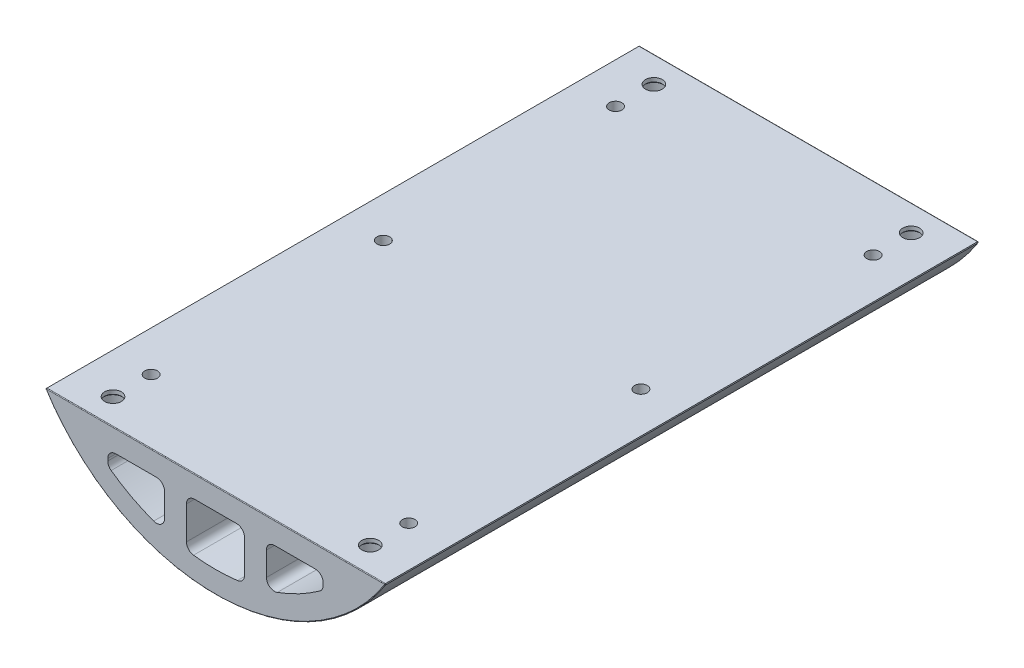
SolidWorks part; units mm, degrees
ref_plane "Plane1" through (0, 0, 0) normal (0, 0, 1) x (1, 0, 0)
ref_plane "Plane2" through (0, 0, 0) normal (0, 1, 0) x (1, 0, 0)
ref_plane "Plane3" through (0, 0, 0) normal (1, 0, 0) x (0, 0, -1)
sketch "Sketch1" plane through (0, 0, 0) normal (0, 0, 1) x (1, 0, 0)
  line L0 (-49.8614, 0) -> (45.8725, 0) construction
  line L1 (0, 51.6066) -> (0, 0) construction
  line L2 (-33.5501, -21.082) -> (33.5501, -21.082)
  line L3 (0, -21.082) -> (0, -39.624) construction
  arc A0 (-33.5501, -21.082) -> (33.5501, -21.082) centre (0, 0) ccw
  arc A2 (-31.7358, -21.082) -> (31.7358, -21.082) centre (0, 0) ccw construction
  dimension "D1" = 79.248
  dimension "D3" = 76.2
  dimension "D2" = 18.542
  dimension "D4" = 21.082
extrude "Base-Extrude" add sketch "Sketch1" along normal mid plane 116.8
sketch "Sketch2" plane through (0, -21.082, 0) normal (0, 1, 0) x (-1, 0, 0)
  line L0 (0, -61.974) -> (0, 64.7864) construction
  line L1 (0, 58.4) -> (0, -58.4) construction
  line L2 (43.7533, 0) -> (-38.0219, 0) construction
  point P7 (25.325, -53.25)
  point P8 (25.325, 53.25)
  point P9 (-25.325, -53.25)
  point P10 (-25.325, 53.25)
  dimension "D1" = 106.5
  dimension "D2" = 50.65
ref_plane "Plane4" through (0, 0, 53.25) normal (0, 0, 1) x (1, 0, 0)
sketch "Sketch3" plane through (0, 0, 53.25) normal (0, 0, 1) x (1, 0, 0)
  line L0 (-25.325, -8.9684) -> (-25.325, -44.1892) construction
  line L1 (-26.825, -17.4975) -> (-26.825, -22.098) construction
  line L2 (-26.825, -22.098) -> (-28.075, -22.098) construction
  line L3 (-28.075, -22.098) -> (-28.075, -25.098) construction
  line L4 (-28.075, -25.098) -> (-22.575, -25.098) construction
  line L5 (-33.5501, -21.082) -> (33.5501, -21.082) construction
  line L6 (-26.825, -17.4975) -> (-23.825, -17.4975) construction
  line L7 (-22.575, -22.098) -> (-22.575, -25.098) construction
  line L8 (-23.825, -22.098) -> (-22.575, -22.098) construction
  line L9 (-23.825, -17.4975) -> (-23.825, -22.098) construction
  line L10 (-25.325, -15.9561) -> (-26.976, -15.9561)
  line L11 (-26.976, -15.9561) -> (-26.976, -21.844)
  line L12 (-27.23, -22.098) -> (-28.3095, -22.098)
  line L13 (-28.4365, -22.225) -> (-28.4365, -38.7043)
  line L14 (-28.4365, -38.7043) -> (-25.325, -38.7043)
  line L15 (-25.325, -38.7043) -> (-25.325, -15.9561)
  line L16 (-27.23, -22.098) -> (-26.976, -21.844)
  arc A1 (-28.4365, -22.225) -> (-28.3095, -22.098) centre (-28.3095, -22.225) cw
  point P15 (-25.325, -17.4975)
  dimension "D9" = 0.127
  dimension "D1" = 2.75
  dimension "D2" = 1.5
  dimension "D3" = 3
  dimension "D4" = 1.016
  dimension "D5" = 6.223
  dimension "D6" = 3.302
  dimension "D7" = 45
  dimension "D8" = 0.254
revolve "Cut-Revolve1" cut sketch "Sketch3" angle 360 about L0
pattern_linear "LPattern1" count 2 spacing 106.5 along (0, 0, -1) count 2 spacing 50.65 along (1, 0, 0) of "Cut-Revolve1"
chamfer "Chamfer4" distance 0.254 angle 45 2 edges at (-33.5501, -21.082, 0) (33.5501, -21.082, 0)
fillet "Fillet1" radius 0.127 8 edges at (-0.0345, -39.624, -58.4) (-0.0345, -39.624, 58.4) (0.0349, -21.082, -58.4) (33.3903, -21.189, -58.4) (-33.374, -21.1598, -58.4) (0.0349, -21.082, 58.4) (33.3903, -21.189, 58.4) (-33.374, -21.1598, 58.4)
ref_plane "Plane6" through (0, 0, 0) normal (0, 0, -1) x (-1, 0, 0)
sketch "Sketch4" plane through (0, 0, 58.4) normal (0, 0, 1) x (1, 0, 0)
  line L0 (0, 8.0197) -> (0, -51.6062) construction
  line L1 (-39.7951, -21.082) -> (38.2144, -21.082) construction
  line L2 (-33.2961, -21.082) -> (33.3659, -21.082) construction
  line L3 (-2.159, -27.0002) -> (-2.159, -33.4955)
  line L4 (-9.525, -27.0002) -> (-9.525, -32.7609)
  line L5 (-13.843, -27.0002) -> (-13.843, -29.9598)
  line L6 (-21.209, -27.0002) -> (-21.209, -27.4149)
  line L7 (7.9248, -25.4) -> (3.7592, -25.4)
  line L8 (9.525, -27.0002) -> (9.525, -32.7609)
  line L9 (19.6088, -25.4) -> (15.4432, -25.4)
  line L10 (2.159, -27.0002) -> (2.159, -33.4955)
  line L13 (-28.4365, -22.225) -> (-28.4365, -38.7043) construction
  line L14 (-22.4365, -22.225) -> (-22.4365, -38.7043) construction
  line L16 (-7.9248, -25.4) -> (-3.7592, -25.4)
  line L17 (-19.6088, -25.4) -> (-15.4432, -25.4)
  line L19 (21.209, -27.0002) -> (21.209, -27.4149)
  line L20 (13.843, -27.0002) -> (13.843, -29.9598)
  arc A0 (-7.9248, -25.4) -> (-9.525, -27.0002) centre (-7.9248, -27.0002) ccw
  arc A1 (-3.7592, -25.4) -> (-2.159, -27.0002) centre (-3.7592, -27.0002) cw
  arc A2 (-8.301, -34.3163) -> (-9.525, -32.7609) centre (-7.9248, -32.7609) cw
  arc A3 (-33.5501, -21.082) -> (33.5501, -21.082) centre (0, 0) ccw construction
  arc A4 (-3.9377, -35.0857) -> (-2.159, -33.4955) centre (-3.7592, -33.4955) ccw
  arc A5 (-8.301, -34.3163) -> (-3.9377, -35.0857) centre (0, 0) ccw
  arc A6 (-20.5397, -28.7164) -> (-16.1764, -31.3821) centre (0, 0) ccw
  arc A7 (8.301, -34.3163) -> (3.9377, -35.0857) centre (0, 0) cw
  arc A8 (-19.6088, -25.4) -> (-21.209, -27.0002) centre (-19.6088, -27.0002) ccw
  arc A9 (-15.4432, -25.4) -> (-13.843, -27.0002) centre (-15.4432, -27.0002) cw
  arc A10 (-20.5397, -28.7164) -> (-21.209, -27.4149) centre (-19.6088, -27.4149) cw
  arc A11 (-16.1764, -31.3821) -> (-13.843, -29.9598) centre (-15.4432, -29.9598) ccw
  arc A12 (3.9377, -35.0857) -> (2.159, -33.4955) centre (3.7592, -33.4955) cw
  arc A13 (8.301, -34.3163) -> (9.525, -32.7609) centre (7.9248, -32.7609) ccw
  arc A14 (3.7592, -25.4) -> (2.159, -27.0002) centre (3.7592, -27.0002) ccw
  arc A15 (7.9248, -25.4) -> (9.525, -27.0002) centre (7.9248, -27.0002) cw
  arc A20 (16.1764, -31.3821) -> (13.843, -29.9598) centre (15.4432, -29.9598) cw
  arc A21 (20.5397, -28.7164) -> (21.209, -27.4149) centre (19.6088, -27.4149) ccw
  arc A22 (15.4432, -25.4) -> (13.843, -27.0002) centre (15.4432, -27.0002) ccw
  arc A23 (19.6088, -25.4) -> (21.209, -27.0002) centre (19.6088, -27.0002) cw
  arc A25 (20.5397, -28.7164) -> (16.1764, -31.3821) centre (0, 0) cw
  arc A31 (-33.4518, -21.2377) -> (33.4147, -21.2959) centre (0, 0) ccw construction
  arc A32 (-33.4518, -21.2377) -> (33.4147, -21.2959) centre (0, 0) ccw construction
  arc A33 (-29.8064, -18.9233) -> (29.7726, -18.9765) centre (0, 0) ccw construction
  point P29 (-9.525, -25.4)
  point P32 (-2.159, -25.4)
  point P39 (-21.209, -25.4)
  dimension "D7" = 35.306
  dimension "D9" = 1.6002
  dimension "D10" = 39.624
  dimension "D13" = 35.306
  dimension "D1" = 4.318
  dimension "D2" = 4.318
  dimension "D3" = 6
  dimension "D4" = 7.366
  dimension "D5" = 4.318
  dimension "D6" = 1.2275
  dimension "D12" = 4.318
extrude "Cut-Extrude1" [suppressed] cut sketch "Sketch4" against normal through all
sketch "Sketch5" plane through (0, 0, 58.4) normal (0, 0, 1) x (1, 0, 0)
  line L0 (0, -8.5994) -> (0, -46.201) construction
  line L1 (-40.8376, -21.082) -> (36.7505, -21.082) construction
  line L2 (-33.2961, -21.082) -> (33.3659, -21.082) construction
  line L3 (-30.3336, -22.5575) -> (28.9581, -22.5575) construction
  line L4 (0, -36.068) -> (0, -39.4617) construction
  line L6 (-6.7553, -14.2413) -> (-6.7553, -43.9022) construction
  line L7 (-9.8211, -14.2413) -> (-9.8211, -43.338) construction
  line L8 (-22.4365, -22.225) -> (-22.4365, -38.7043) construction
  circle A0 centre (0, -29.3127) radius 6.7553
  circle A1 centre (-14.7267, -27.4631) radius 4.9056
  arc A5 (-30.0432, -19.9576) -> (30.0432, -19.9576) centre (0, 0) ccw construction
  circle A6 centre (14.7267, -27.4631) radius 4.9056
  dimension "D1" = 3.0659
  dimension "D2" = 2.8042
  dimension "D5" = 36.068
  dimension "D6" = 3.0659
  dimension "D4" = 9.8112
  dimension "D7" = 13.5105
  dimension "D3" = 1.4755
extrude "Cut-Extrude2" [suppressed] cut sketch "Sketch5" against normal through all
sketch "Sketch6" plane through (0, 0, 58.4) normal (0, 0, 1) x (1, 0, 0)
  line L0 (-19.6215, -25.4) -> (-11.6205, -25.4)
  line L2 (0, 5.8356) -> (0, -52.9242) construction
  line L3 (-5.715, -26.9875) -> (-5.715, -33.4649)
  line L4 (-10.033, -26.9875) -> (-10.033, -31.6528)
  line L5 (-21.209, -26.9875) -> (-21.209, -27.4214)
  line L6 (-4.1275, -25.4) -> (4.1275, -25.4)
  line L7 (21.209, -26.9875) -> (21.209, -27.4214)
  line L8 (10.033, -26.9875) -> (10.033, -31.6528)
  line L9 (5.715, -26.9875) -> (5.715, -33.4649)
  line L10 (19.6215, -25.4) -> (11.6205, -25.4)
  line L11 (-22.4365, -15.3622) -> (-22.4365, -35.4317) construction
  line L12 (-33.2961, -21.082) -> (33.3659, -21.082) construction
  arc A0 (-4.3218, -35.0405) -> (4.3218, -35.0405) centre (0, 0) ccw
  arc A1 (20.5453, -28.7124) -> (12.1676, -33.1431) centre (0, 0) cw
  arc A2 (-29.8064, -18.9233) -> (29.7734, -18.9752) centre (0, 0) ccw
  arc A3 (-20.5453, -28.7124) -> (-12.1676, -33.1431) centre (0, 0) ccw
  arc A4 (-21.209, -26.9875) -> (-19.6215, -25.4) centre (-19.6215, -26.9875) cw
  arc A5 (-20.5453, -28.7124) -> (-21.209, -27.4214) centre (-19.6215, -27.4214) cw
  arc A6 (-12.1676, -33.1431) -> (-10.033, -31.6528) centre (-11.6205, -31.6528) ccw
  arc A7 (-11.6205, -25.4) -> (-10.033, -26.9875) centre (-11.6205, -26.9875) cw
  arc A8 (-4.1275, -25.4) -> (-5.715, -26.9875) centre (-4.1275, -26.9875) ccw
  arc A9 (-4.3218, -35.0405) -> (-5.715, -33.4649) centre (-4.1275, -33.4649) cw
  arc A10 (4.3218, -35.0405) -> (5.715, -33.4649) centre (4.1275, -33.4649) ccw
  arc A11 (4.1275, -25.4) -> (5.715, -26.9875) centre (4.1275, -26.9875) cw
  arc A12 (11.6205, -25.4) -> (10.033, -26.9875) centre (11.6205, -26.9875) ccw
  arc A13 (10.033, -31.6528) -> (12.1676, -33.1431) centre (11.6205, -31.6528) ccw
  arc A14 (21.209, -27.4214) -> (20.5453, -28.7124) centre (19.6215, -27.4214) cw
  arc A15 (19.6215, -25.4) -> (21.209, -26.9875) centre (19.6215, -26.9875) cw
  point P20 (0, -25.4)
  point P25 (-21.209, -25.4)
  point P28 (-21.209, -28.2257)
  point P31 (-10.033, -33.8504)
  point P34 (-10.033, -25.4)
  point P37 (-5.715, -25.4)
  point P40 (-5.715, -34.8404)
  point P43 (5.715, -34.8404)
  point P46 (5.715, -25.4)
  point P49 (10.033, -25.4)
  point P52 (10.033, -33.8504)
  point P55 (21.209, -28.2257)
  point P58 (21.209, -25.4)
  dimension "D8" = 1.5875
  dimension "D2" = 4.318
  dimension "D3" = 4.318
  dimension "D4" = 11.43
  dimension "D5" = 11.176
  dimension "D6" = 22.4365
  dimension "D7" = 1.2275
  dimension "D1" = 4.318
extrude "Cut-Extrude3" cut sketch "Sketch6" against normal through all
sketch "Sketch7" plane through (0, 0, 58.4) normal (0, 0, 1) x (1, 0, 0)
  line L0 (0, 7.2059) -> (0, -47.1993) construction
  line L1 (-22.4365, -22.225) -> (-22.4365, -38.7043) construction
  line L2 (0, 0) -> (-13.5124, -47.1924) construction
  line L3 (-33.2961, -26.162) -> (33.3659, -26.162)
  line L4 (-18.7529, -26.162) -> (-10.9969, -26.162)
  line L5 (-10.2399, -27.1661) -> (-11.5264, -31.6592)
  line L6 (-5.1927, -26.7327) -> (-6.9764, -32.962)
  line L7 (-4.4358, -26.162) -> (4.4358, -26.162)
  line L8 (5.1927, -26.7327) -> (6.9764, -32.962)
  line L9 (10.2399, -27.1661) -> (11.5264, -31.6592)
  line L10 (10.9969, -26.162) -> (18.7529, -26.162)
  arc A0 (-18.7529, -26.162) -> (-19.483, -28.5255) centre (-18.7529, -27.4565) ccw
  arc A1 (-6.3645, -33.9526) -> (6.3645, -33.9526) centre (0, 0) ccw
  arc A2 (-29.1631, -18.5149) -> (29.1308, -18.5657) centre (0, 0) ccw
  arc A3 (-19.483, -28.5255) -> (-12.5699, -32.1759) centre (0, 0) ccw
  arc A4 (18.7529, -26.162) -> (19.483, -28.5255) centre (18.7529, -27.4565) cw
  arc A5 (12.5699, -32.1759) -> (19.483, -28.5255) centre (0, 0) ccw
  arc A6 (-10.9969, -26.162) -> (-10.2399, -27.1661) centre (-10.9969, -26.9494) cw
  arc A7 (-12.5699, -32.1759) -> (-11.5264, -31.6592) centre (-12.2833, -31.4424) ccw
  arc A8 (-6.3645, -33.9526) -> (-6.9764, -32.962) centre (-6.2194, -33.1787) cw
  arc A9 (-4.4358, -26.162) -> (-5.1927, -26.7327) centre (-4.4358, -26.9494) ccw
  arc A10 (4.4358, -26.162) -> (5.1927, -26.7327) centre (4.4358, -26.9494) cw
  arc A11 (6.3645, -33.9526) -> (6.9764, -32.962) centre (6.2194, -33.1787) ccw
  arc A12 (12.5699, -32.1759) -> (11.5264, -31.6592) centre (12.2833, -31.4424) cw
  arc A13 (10.9969, -26.162) -> (10.2399, -27.1661) centre (10.9969, -26.9494) ccw
  point P27 (-9.9524, -26.162)
  point P30 (-11.7614, -32.4801)
  point P33 (-7.2114, -33.7829)
  point P36 (-5.0294, -26.162)
  point P39 (5.0294, -26.162)
  point P42 (7.2114, -33.7829)
  point P45 (11.7614, -32.4801)
  point P48 (9.9524, -26.162)
  dimension "D3" = 2.589
  dimension "D4" = 2.3891
  dimension "D7" = 0.7874
  dimension "D5" = 15.978
  dimension "D6" = 4.7328
  dimension "D1" = 5.08
  dimension "D2" = 5.08
extrude "Cut-Extrude4" [suppressed] cut sketch "Sketch7" against normal through all
sketch "Sketch8" plane through (0, 0, 58.4) normal (0, 0, 1) x (1, 0, 0)
  line L0 (0, 5.2199) -> (0, -48.5956) construction
  line L1 (-1.821, -27.7495) -> (-1.821, -33.5458)
  line L2 (1.821, -27.7495) -> (1.821, -33.5458)
  line L3 (-33.2961, -26.162) -> (33.3659, -26.162)
  line L4 (-18.4288, -26.162) -> (-3.4085, -26.162)
  line L5 (-22.4457, -18.4737) -> (-22.4457, -40.1731) construction
  line L6 (3.4085, -26.162) -> (18.4288, -26.162)
  arc A0 (-18.4288, -26.162) -> (-19.4243, -29.4824) centre (-18.4288, -27.9714) ccw
  arc A1 (3.569, -35.1251) -> (19.4243, -29.4824) centre (0, 0) ccw
  arc A2 (-3.4085, -26.162) -> (-1.821, -27.7495) centre (-3.4085, -27.7495) cw
  arc A3 (-3.569, -35.1251) -> (-1.821, -33.5458) centre (-3.4085, -33.5458) ccw
  arc A4 (-19.4243, -29.4824) -> (-3.569, -35.1251) centre (0, 0) ccw
  arc A5 (3.569, -35.1251) -> (1.821, -33.5458) centre (3.4085, -33.5458) cw
  arc A6 (3.4085, -26.162) -> (1.821, -27.7495) centre (3.4085, -27.7495) ccw
  arc A7 (18.4288, -26.162) -> (19.4243, -29.4824) centre (18.4288, -27.9714) cw
  point P13 (-1.821, -26.162)
  point P21 (-1.821, -35.259)
  point P24 (1.821, -35.259)
  point P27 (1.821, -26.162)
  dimension "D5" = 1.8094
  dimension "D1" = 35.306
  dimension "D6" = 2.2074
  dimension "D7" = 1.5875
  dimension "D3" = 22.4457
  dimension "D4" = 3.6421
  dimension "D2" = 5.08
extrude "Cut-Extrude5" [suppressed] cut sketch "Sketch8" against normal through all
hole_wizard "M3x0.5 Tapped Hole1" positions "3DSketch2" profile "Sketch10" tap size "M3x0.5" standard "Ansi Metric"
sketch3d "3DSketch2"
  line L3 (33.3659, -21.082, 58.273) -> (33.3659, -21.082, -58.273) construction
  point P0 (25.3649, -21.082, -45.72)
  dimension "D1" = 8.001
  dimension "D2" = 45.72
sketch "Sketch10" plane through (25.3649, -21.082, -45.72) normal (1, 0, 0) x (0, 0, 1)
  line L0 (0, 0) -> (0, 18.542)
  line L1 (0, 18.542) -> (1.25, 18.542)
  line L2 (1.25, 18.542) -> (1.25, 0)
  line L5 (1.25, 0) -> (0, 0)
  line L11 (0, -6.35) -> (0, 107.95) construction
  dimension "Thru Tap Drill Dia." = 2.5
  dimension "Thru Tap Drill Depth" = 18.542
pattern_linear "LPattern2" count 3 spacing 45.72 along (0, 0, 1) of "M3x0.5 Tapped Hole1"
ref_plane "Plane5" through (0.0106, 0, 0) normal (-1, 0, 0) x (0, 0, 1)
mirror "Mirror2" about plane through (0.0106, 0, 0) normal (-1, 0, 0) of "M3x0.5 Tapped Hole1", "LPattern2"
